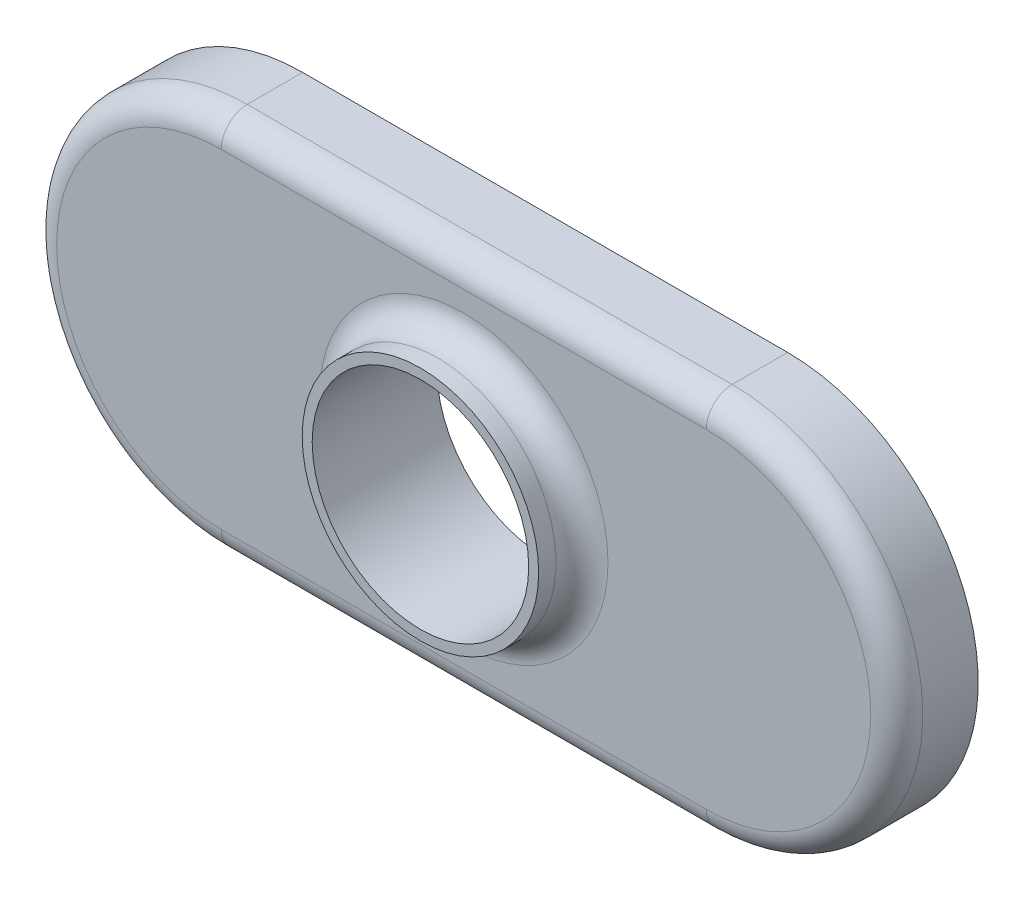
SolidWorks part; units mm, degrees
ref_plane "Front"
ref_plane "Top" through (0, 0, 0) normal (0, 1, 0) x (1, 0, 0)
ref_plane "Right" through (0, 0, 0) normal (1, 0, 0) x (0, 0, -1)
sketch "Sketch1" plane through (0, 0, 0) normal (0, 0, 1) x (1, 0, 0)
  line L1 (0, 0) -> (25.4, 0)
  line L2 (0, 0) -> (0, 11.176)
  line L3 (0, 11.176) -> (25.4, 11.176)
  line L4 (25.4, 0) -> (25.4, 11.176)
  dimension "D1" = 11.176
  dimension "D2" = 25.4
extrude "Base-Extrude" add sketch "Sketch1" against normal blind 2.3876
sketch "Sketch2" plane through (0, 0, 0) normal (0, 0, 1) x (1, 0, 0)
  line L0 (0, 11.176) -> (25.4, 0) construction
  circle A0 centre (12.7, 5.588) radius 3.4671
  dimension "D1" = 6.9342
extrude "Boss-Extrude1" add sketch "Sketch2" along normal blind 1.27
hole_wizard "1/4-20 Tapped Hole1" positions "3DSketch1" profile "Sketch3" tap size "1/4-20" standard "Ansi Inch"
sketch3d "3DSketch1"
  line L0 (12.7, 5.588, 1.27) -> (12.7, 5.588, 0) construction
  point P0 (12.7, 5.588, 1.27)
  point P3 (12.7, 5.588, 1.27)
sketch "Sketch3" plane through (12.7, 5.588, 1.27) normal (1, 0, 0) x (0, -1, 0)
  line L0 (0, 0) -> (0, 3.6576)
  line L1 (0, 3.6576) -> (2.5527, 3.6576)
  line L3 (2.5527, 3.6576) -> (2.5527, 12.7)
  line L4 (2.5527, 12.7) -> (3.175, 12.7)
  line L5 (3.175, 12.7) -> (3.175, 0)
  line L7 (3.175, 0) -> (0, 0)
  line L11 (0, -6.35) -> (0, 107.95) construction
  dimension "Thru Tap Drill Dia." = 5.1054
  dimension "Thru Tap Drill Depth" = 3.6576
  dimension "Thread Dia." = 6.35
  dimension "Thread Depth" = 12.7
sketch "Sketch4" plane through (0, 0, 0) normal (0, 0, 1) x (1, 0, 0)
  line L0 (25.4, 11.176) -> (0, 11.176) construction
  line L1 (0, 0) -> (25.4, 0) construction
  line L2 (25.4, 0) -> (25.4, 11.176) construction
  arc A0 (19.812, 11.176) -> (19.812, 0) centre (19.812, 5.588) cw
extrude "Cut-Extrude1" cut sketch "Sketch4" against normal through all and the other way through all
sketch "Sketch5" plane through (0, 0, 0) normal (0, 0, 1) x (1, 0, 0)
  line L0 (19.812, 11.176) -> (0, 11.176) construction
  line L1 (0, 0) -> (19.812, 0) construction
  line L2 (0, 11.176) -> (0, 0) construction
  arc A0 (5.588, 11.176) -> (5.588, 0) centre (5.588, 5.588) ccw
extrude "Cut-Extrude2" cut sketch "Sketch5" against normal through all and the other way through all flip side to cut
fillet "Fillet1" radius 0.762
